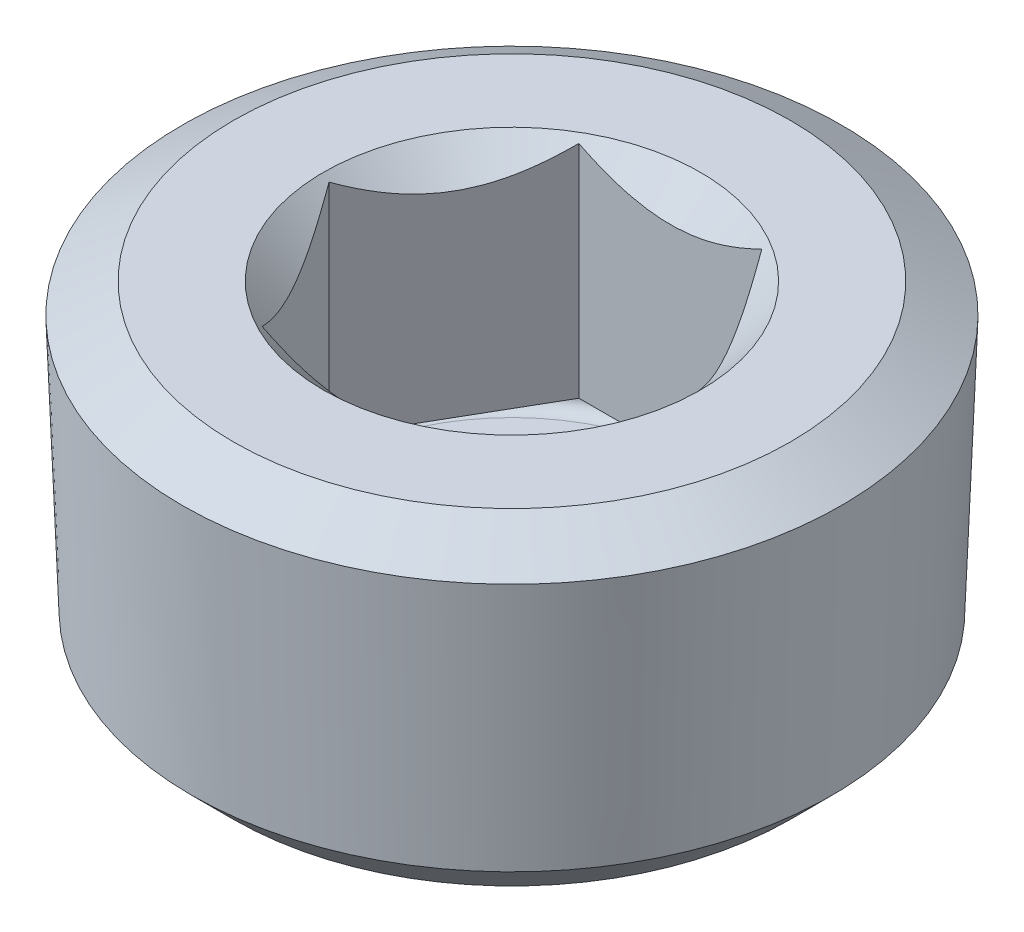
SolidWorks part; units mm, degrees
ref_plane "Front Plane" through (0, 0, 0) normal (0, 0, 1) x (1, 0, 0)
ref_plane "Top Plane" through (0, 0, 0) normal (0, 1, 0) x (1, 0, 0)
ref_plane "Right Plane" through (0, 0, 0) normal (1, 0, 0) x (0, 0, -1)
sketch "Sketch2" plane through (0, 0, 0) normal (0, 0, 1) x (1, 0, 0)
  line L0 (0, 10.7443) -> (0, -17.0657) construction
  line L1 (0, 0) -> (-14.0666, 0)
  line L2 (-16.6462, -1.4894) -> (-16.1755, -14.4011)
  line L3 (-14.0666, -16.51) -> (0, -16.51)
  line L4 (0, -16.51) -> (0, 0)
  line L6 (-14.0666, -16.51) -> (-16.1755, -14.4011)
  line L7 (-14.0666, 0) -> (-16.6462, -1.4894)
  point P4 (-16.7005, 0)
  point P6 (-16.0986, -16.51)
  dimension "D1" = 16.51
  dimension "D2" = 2.088
  dimension "D3" = 33.401
  dimension "D4" = 30
  dimension "D5" = 2.032
  dimension "D6" = 45
revolve "Revolve1" add sketch "Sketch2" angle 360 about L0
sketch "Sketch3" plane through (0, 0, 0) normal (0, 0, 1) x (1, 0, 0)
  line L0 (0, 2.9342) -> (0, -18.7525) construction
  line L1 (0, 0) -> (-9.525, 0)
  line L2 (14.0666, 0) -> (-14.0666, 0) construction
  line L3 (-8.001, -1.524) -> (-8.001, -11.43)
  line L4 (-9.525, -12.7) -> (0, -12.7)
  line L5 (0, -12.7) -> (0, 0)
  line L6 (-8.001, -1.524) -> (-9.525, 0)
  line L7 (-8.001, -11.43) -> (-9.525, -11.43)
  arc A0 (-9.525, -11.43) -> (-9.525, -12.7) centre (-9.525, -12.065) ccw
  dimension "D1" = 11.43
  dimension "D2" = 12.7
  dimension "D3" = 16.002
  dimension "D4" = 1.524
  dimension "D5" = 45
  dimension "D6" = 1.524
revolve "Cut-Revolve1" cut sketch "Sketch3" angle 360 about L0
sketch "Sketch4" plane through (0, 0, 0) normal (0, 1, 0) x (1, 0, 0)
  line L1 (-4.6194, -8.001) -> (4.6194, -8.001)
  line L2 (4.6194, -8.001) -> (9.2388, 0)
  line L3 (9.2388, 0) -> (4.6194, 8.001)
  line L4 (4.6194, 8.001) -> (-4.6194, 8.001)
  line L5 (-4.6194, 8.001) -> (-9.2388, 0)
  line L6 (-9.2388, 0) -> (-4.6194, -8.001)
  circle A0 centre (0, 0) radius 8.001 construction
  circle A1 centre (0, 0) radius 8.001 construction
extrude "Cut-Extrude1" cut sketch "Sketch4" against normal up to vertex (5.2929 mm away)
